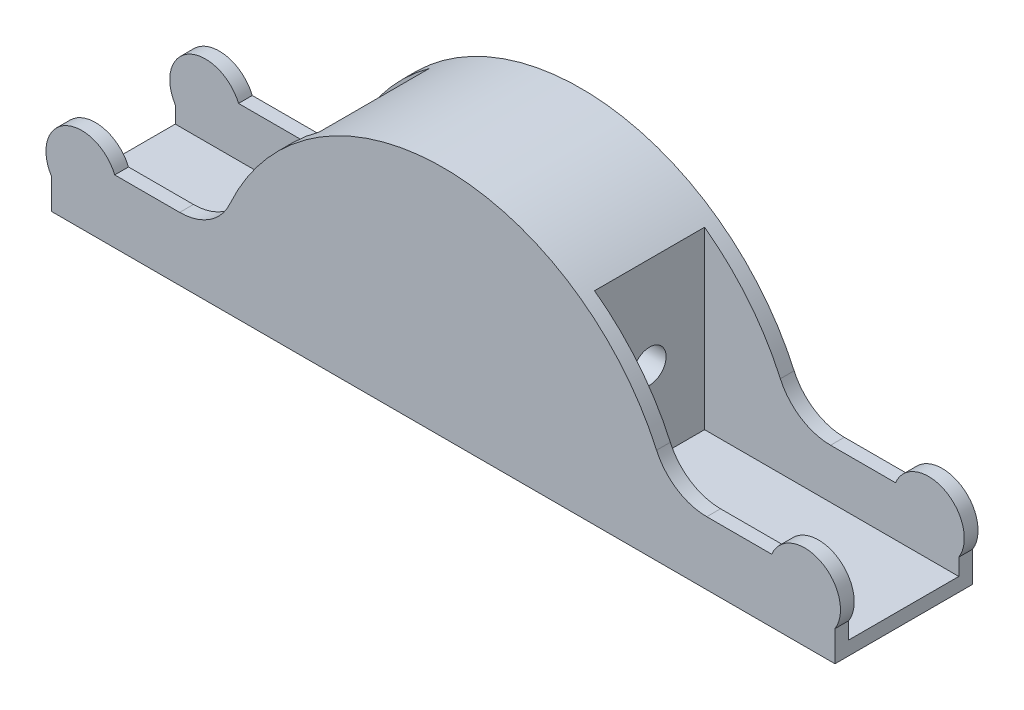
SolidWorks part; units mm, degrees
ref_plane "Front Plane" through (0, 0, 0) normal (0, 0, 1) x (1, 0, 0)
ref_plane "Top Plane" through (0, 0, 0) normal (0, 1, 0) x (1, 0, 0)
ref_plane "Right Plane" through (0, 0, 0) normal (1, 0, 0) x (0, 0, -1)
sketch "Sketch1" plane through (0, 0, 0) normal (0, 0, 1) x (1, 0, 0)
  line L0 (-712, 0) -> (712, 0)
  line L1 (-712, 0) -> (-712, 55.359)
  line L2 (-597, 115) -> (-478.9572, 115)
  line L3 (712, 55.359) -> (712, 0)
  line L4 (478.9572, 115) -> (597, 115)
  line L5 (0, 0) -> (-657, 0) construction
  line L6 (-657, 0) -> (-657, 90) construction
  line L7 (0, 0) -> (0, 425) construction
  arc A1 (387.7273, 174.0476) -> (-387.7273, 174.0476) centre (0, 0) ccw
  arc A2 (478.9572, 115) -> (387.7273, 174.0476) centre (478.9572, 215) cw
  arc A3 (-478.9572, 115) -> (-387.7273, 174.0476) centre (-478.9572, 215) ccw
  arc A4 (-597, 115) -> (-712, 55.359) centre (-657, 90) ccw
  arc A5 (597, 115) -> (712, 55.359) centre (657, 90) cw
  point P12 (409.1455, 115)
  dimension "D2" = 100
  dimension "D5" = 115
  dimension "D6" = 425
  dimension "D7" = 425
  dimension "D1" = 1424
  dimension "D3" = 657
  dimension "D4" = 90
extrude "Boss-Extrude1" add sketch "Sketch1" along normal blind 250
sketch "Sketch2" plane through (0, 0, 0) normal (0, -1, 0) x (1, 0, 0)
  line L0 (-722, 250) -> (-722, 0) construction
  line L1 (-722, 25) -> (-250, 25)
  line L2 (-722, 25) -> (-722, 225)
  line L3 (-722, 225) -> (-250, 225)
  line L4 (-250, 25) -> (-250, 225)
  line L5 (-478.9572, 0) -> (-597, 0) construction
  line L6 (-478.9572, 250) -> (-597, 250) construction
  line L7 (0, 0) -> (0, 250) construction
  line L8 (387.7273, 250) -> (-387.7273, 250) construction
  line L9 (722, 225) -> (250, 225)
  line L10 (722, 25) -> (250, 25)
  line L11 (722, 25) -> (722, 225)
  line L12 (250, 25) -> (250, 225)
  dimension "D1" = 25
  dimension "D2" = 25
  dimension "D3" = 250
extrude "Cut-Extrude1" cut sketch "Sketch2" against normal blind 596 from offset 25
sketch "Sketch3" plane through (-250, 0, 0) normal (-1, 0, 0) x (0, 0, 1)
  line L0 (125, 0) -> (125, 175) construction
  line L1 (250, 0) -> (0, 0) construction
  circle A0 centre (125, 175) radius 30
  dimension "D2" = 60
  dimension "D1" = 175
extrude "Cut-Extrude2" cut sketch "Sketch3" against normal blind 596
